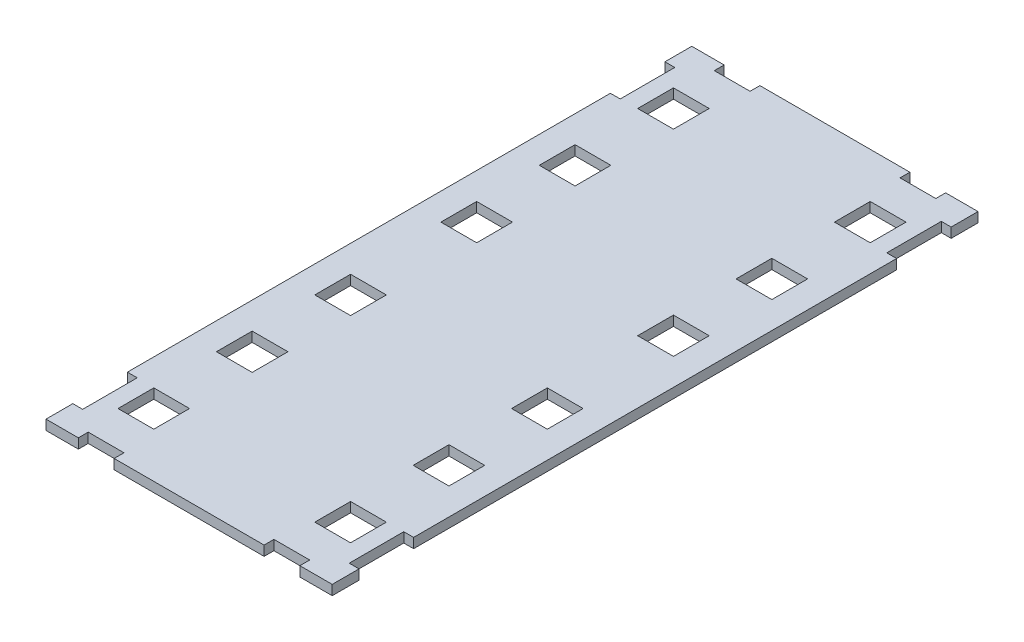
SolidWorks part; units mm, degrees
ref_plane "Alzado" through (0, 0, 0) normal (0, 0, 1) x (1, 0, 0)
ref_plane "Planta" through (0, 0, 0) normal (0, 1, 0) x (1, 0, 0)
ref_plane "Vista lateral" through (0, 0, 0) normal (1, 0, 0) x (0, 0, -1)
sketch "Croquis2" plane through (0, 0, 0) normal (0, 1, 0) x (1, 0, 0)
  line L0 (0, 140.5) -> (0, 321) construction
  line L1 (61.9143, 321) -> (61.9143, 315.5)
  line L2 (0, 0) -> (80, 0)
  line L3 (0, 140.5) -> (0, 321)
  line L4 (0, 321) -> (41.9143, 321)
  line L5 (80, 140.5) -> (80, 275.5)
  line L6 (61.9143, 315.5) -> (41.9143, 315.5)
  line L7 (41.9143, 315.5) -> (41.9143, 321)
  line L8 (61.9143, 321) -> (80, 321)
  line L9 (80, 306) -> (74.5, 306)
  line L10 (74.5, 306) -> (74.5, 275.5)
  line L11 (74.5, 275.5) -> (80, 275.5)
  line L12 (80, 306) -> (80, 321)
  line L13 (0, 140.5) -> (80, 140.5) construction
  line L14 (0, 140.5) -> (80, 140.5)
  dimension "D2" = 80
  dimension "D3" = 20
  dimension "D4" = 5.5
  dimension "D5" = 30.5
  dimension "D6" = 15
  dimension "D7" = 180.5
extrude "Saliente-Extruir1" add sketch "Croquis2" along normal blind 5.5 contours L3 L14 L5 L11 L10 L9 L12 L8 L1 L6 L7 L4
sketch "Croquis4" plane through (0, 0, 0) normal (0, 1, 0) x (1, 0, 0)
  line L0 (0, 285.75) -> (80, 285.75) construction
  line L1 (0, 140.5) -> (0, 321) construction
  line L2 (80, 306) -> (80, 321) construction
  line L3 (80, 321) -> (55, 321) construction
  line L6 (55, 321) -> (55, 140.5) construction
  line L7 (0, 140.5) -> (80, 140.5) construction
  line L9 (65, 275.75) -> (45, 275.75)
  line L10 (65, 275.75) -> (65, 295.75)
  line L11 (65, 295.75) -> (45, 295.75)
  line L12 (45, 275.75) -> (45, 295.75)
  line L13 (65, 275.75) -> (45, 295.75) construction
  line L14 (65, 295.75) -> (45, 275.75) construction
  line L15 (65, 220.75) -> (45, 220.75)
  line L16 (65, 220.75) -> (65, 240.75)
  line L17 (65, 240.75) -> (45, 240.75)
  line L18 (45, 220.75) -> (45, 240.75)
  line L19 (65, 220.75) -> (45, 240.75) construction
  line L20 (65, 240.75) -> (45, 220.75) construction
  line L21 (65, 165.75) -> (45, 165.75)
  line L22 (65, 165.75) -> (65, 185.75)
  line L23 (65, 185.75) -> (45, 185.75)
  line L24 (45, 165.75) -> (45, 185.75)
  line L25 (65, 165.75) -> (45, 185.75) construction
  line L26 (65, 185.75) -> (45, 165.75) construction
  point P12 (55, 285.75)
  point P18 (55, 230.75)
  point P23 (55, 175.75)
  dimension "D2" = 20
  dimension "D3" = 20
  dimension "D4" = 20
  dimension "D5" = 35
  dimension "D6" = 35
extrude "Cortar-Extruir3" cut sketch "Croquis4" along normal blind 10 contours L10 L9 L12 L11 | L16 L15 L18 L17 | L22 L21 L24 L23
mirror "Simetría3" about plane through (0, 5.5, 0) normal (-1, 0, 0)
mirror "Simetría4" about plane through (0, 5.5, -140.5) normal (0, 0, -1)
